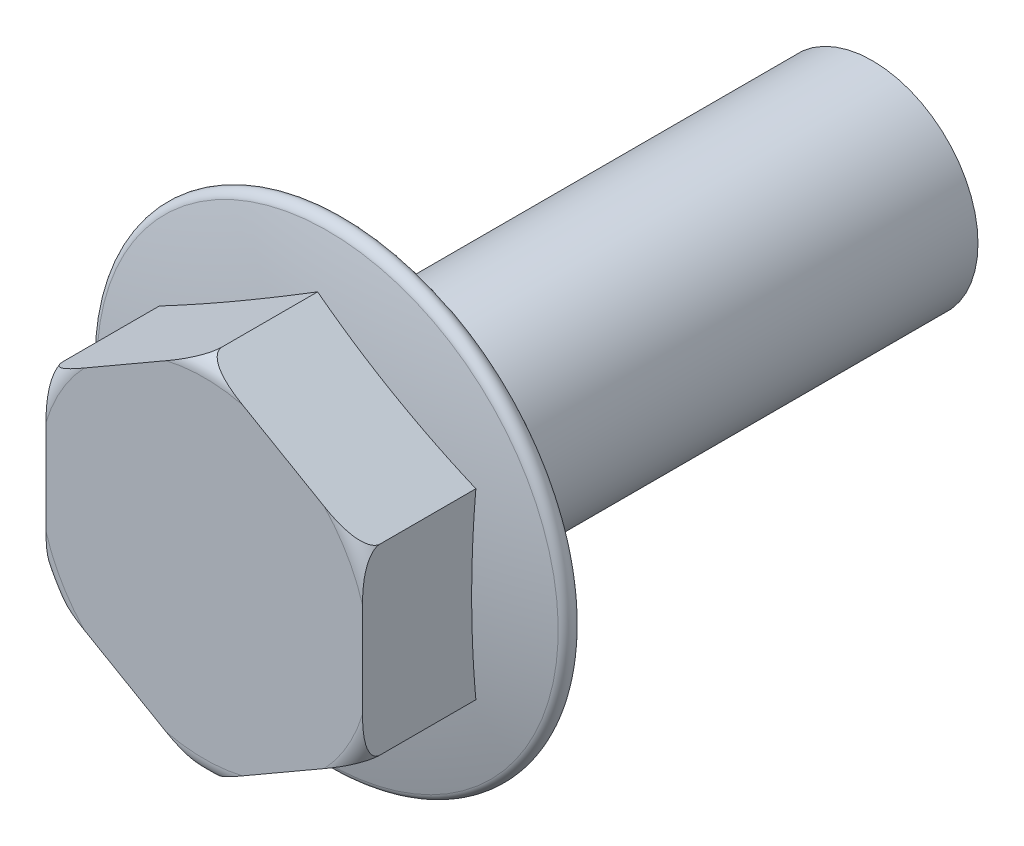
SolidWorks part; units mm, degrees
ref_plane "Plane1" through (0, 0, 0) normal (0, 0, 1) x (1, 0, 0)
ref_plane "Plane2" through (0, 0, 0) normal (0, 1, 0) x (-1, 0, 0)
ref_plane "Plane3" through (0, 0, 0) normal (1, 0, 0) x (0, 0, -1)
sketch "Head Sketch" plane through (0, 0, 0) normal (0, 0, 1) x (1, 0, 0)
  line L0 (0, 10.3923) -> (9, 5.1962)
  line L1 (9, 5.1962) -> (9, -5.1962)
  line L2 (9, -5.1962) -> (0, -10.3923)
  line L3 (0, -10.3923) -> (-9, -5.1962)
  line L4 (-9, -5.1962) -> (-9, 5.1962)
  line L5 (-9, 5.1962) -> (0, 10.3923)
  line L6 (9, 5.1962) -> (-9, -5.1962) construction
  line L7 (0, 10.3923) -> (0, -10.3923) construction
  line L8 (-9, 5.1962) -> (9, -5.1962) construction
  point P0 (0, 0)
  dimension "D1" = 60
  dimension "D2" = 60
  dimension "Flats" = 18
extrude "Head" add sketch "Head Sketch" along normal blind 8
sketch "Flange Sketch" plane through (0, 0, 0) normal (0, 1, 0) x (-1, 0, 0)
  line L0 (0, 1.8434) -> (0, 2.5) construction
  line L1 (-13, 0) -> (0, 0)
  line L2 (0, 50) -> (0, -50) construction
  line L4 (0, 0) -> (0, 2.5)
  line L5 (0, 0) -> (-9, 0) construction
  arc A0 (0, 2.5) -> (-13.1139, 0.9869) centre (0, -55.0833) ccw
  arc A1 (-13, 0) -> (-13.1139, 0.9869) centre (-13, 0.5) cw
  dimension "D1" = 0.5
  dimension "D3" = 26
  dimension "Flange Height" = 2.5
revolve "Flange" add sketch "Flange Sketch" angle 360 about L0
sketch "Sketch5" plane through (0, 0, 0) normal (1, 0, 0) x (0, 0, -1)
  line L0 (-8, -9.3923) -> (-8, -10.3923)
  line L1 (-8, -10.3923) -> (-7, -10.3923)
  line L2 (-8, -10.3923) -> (-1.5545, -10.3923) construction
  line L3 (-8, -10.3923) -> (-8, -5.1962) construction
  line L5 (-15.0856, 0) -> (-8.1394, 0) construction
  line L6 (50, 0) -> (-50, 0) construction
  arc A0 (-8, -9.3923) -> (-7, -10.3923) centre (-7, -9.3923) ccw
  dimension "D1" = 1
revolve "Head Trim" cut sketch "Sketch5" angle 360 about L5
sketch "Esquisse1" plane through (0, 0, 0) normal (0, 0, -1) x (-1, 0, 0)
  circle A0 centre (0, 0) radius 6
  dimension "D1" = 12
extrude "Boss.-Extru.1" add sketch "Esquisse1" along normal blind 30
